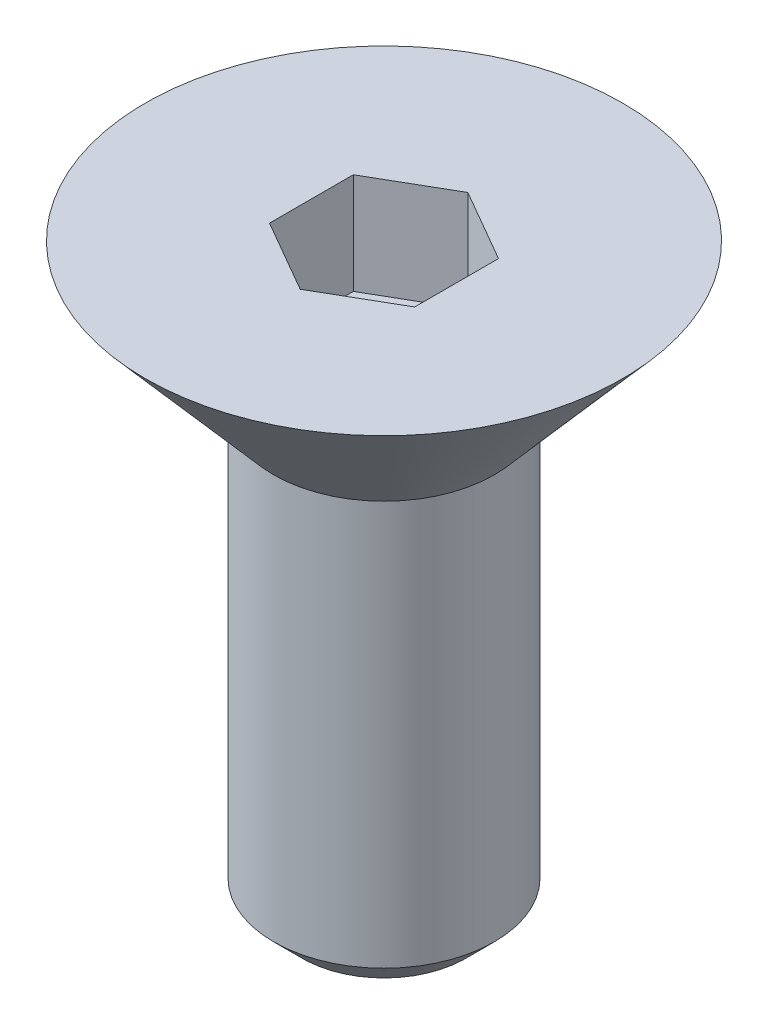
SolidWorks part; units mm, degrees
ref_plane "Front" through (0, 0, 0) normal (0, 0, 1) x (1, 0, 0)
ref_plane "Top" through (0, 0, 0) normal (0, 1, 0) x (1, 0, 0)
ref_plane "Right" through (0, 0, 0) normal (1, 0, 0) x (0, 0, -1)
sketch "Sketch1" plane through (0, 0, 0) normal (0, 0, 1) x (1, 0, 0)
  line L0 (0, 0) -> (2.413, 0)
  line L1 (2.413, 0) -> (5.2197, 3.2258)
  line L2 (5.2197, 3.2258) -> (0, 3.2258)
  line L3 (0, 3.2258) -> (0, 0)
  line L4 (0, 0) -> (0, 100) construction
revolve "Base-Revolve" add sketch "Sketch1" angle 360 about L4
sketch "Sketch2" plane through (0, 0, 0) normal (0, 0, 1) x (1, 0, 0)
  line L0 (0, 0) -> (0, 100) construction
  line L1 (0, -9.4742) -> (1.7831, -9.4742)
  line L2 (1.7831, -9.4742) -> (2.413, -8.8443)
  line L3 (2.413, -8.8443) -> (2.413, 0)
  line L4 (2.413, 0) -> (0, 0)
  line L5 (0, 0) -> (0, -9.4742)
  line L6 (5.2197, 3.2258) -> (-5.2197, 3.2258) construction
  dimension "D1" = 12.7
revolve "Boss-Revolve1" add sketch "Sketch2" angle 360 about L0
ref_plane "Plane4" through (0, 3.2258, 0) normal (0, 1, 0) x (-1, 0, 0)
sketch "Sketch3" plane through (0, 3.2258, 0) normal (0, 1, 0) x (-1, 0, 0)
  line L0 (1.5875, 0.9165) -> (0, 1.8331)
  line L1 (0, 1.8331) -> (-1.5875, 0.9165)
  line L2 (-1.5875, 0.9165) -> (-1.5875, -0.9165)
  line L3 (-1.5875, -0.9165) -> (0, -1.8331)
  line L4 (0, -1.8331) -> (1.5875, -0.9165)
  line L5 (1.5875, -0.9165) -> (1.5875, 0.9165)
extrude "Cut-Extrude1" cut sketch "Sketch3" against normal blind 2.2098
